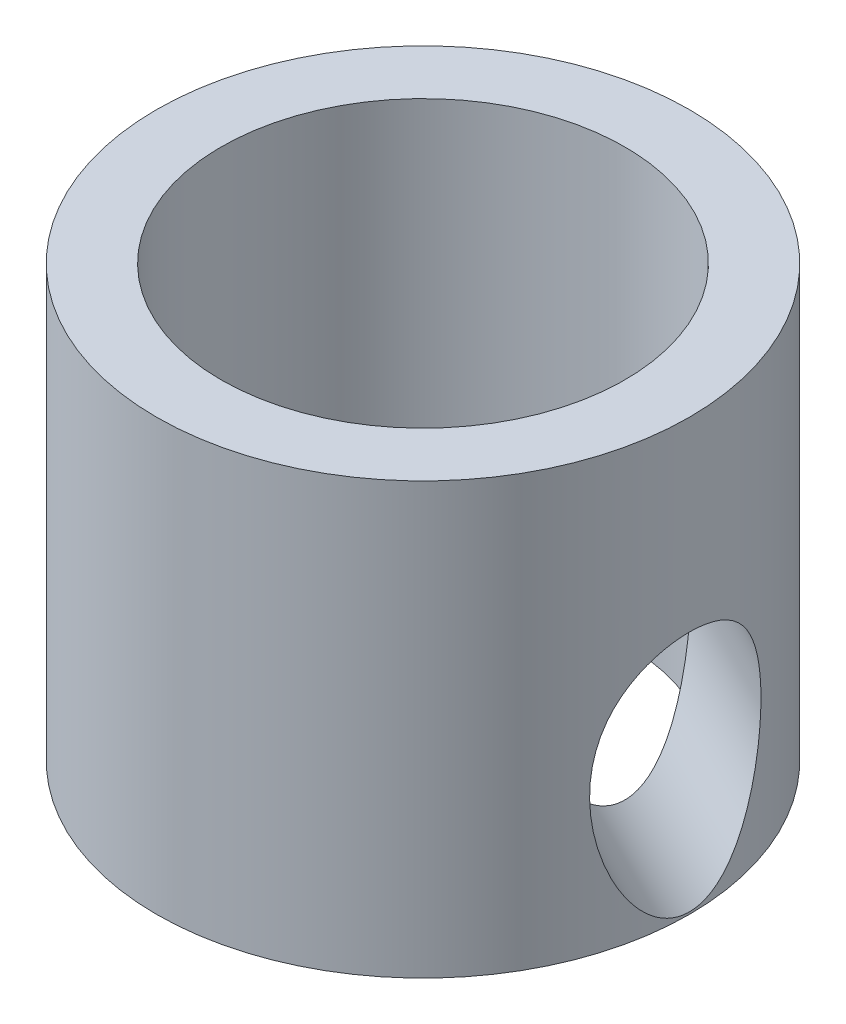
SolidWorks part; units mm, degrees
ref_plane "Front Plane" through (0, 0, 0) normal (0, 0, 1) x (1, 0, 0)
ref_plane "Top Plane" through (0, 0, 0) normal (0, 1, 0) x (1, 0, 0)
ref_plane "Right Plane" through (0, 0, 0) normal (1, 0, 0) x (0, 0, -1)
sketch "Sketch1" plane through (0, 0, 0) normal (0, 1, 0) x (1, 0, 0)
  circle A0 centre (0, 0) radius 62.865
  circle A1 centre (0, 0) radius 47.625
  dimension "D1" = 95.25
  dimension "D2" = 125.73
extrude "Boss-Extrude1" add sketch "Sketch1" along normal blind 101.6
ref_plane "Plane1" through (0, 38.1, 0) normal (0, 1, 0) x (-1, 0, 0)
sketch "Sketch2" plane through (0, 38.1, 0) normal (0, 1, 0) x (-1, 0, 0)
  line L0 (0, 62.865) -> (0, -62.865)
  circle A0 centre (0, 0) radius 62.865 construction
ref_plane "Plane2" through (-19.05, 19.05, 0) normal (0.7071, -0.7071, 0) x (0, 0, -1)
sketch "Sketch3" plane through (-19.05, 19.05, 0) normal (0.7071, -0.7071, 0) x (0, 0, -1)
  line L0 (0, 55) -> (0, -55) construction
  line L1 (-62.865, 26.9408) -> (62.865, 26.9408) construction
  circle A0 centre (0, 65.0408) radius 20.2184
  dimension "D1" = 40.4368
  dimension "D2" = 38.1
extrude "Cut-Extrude1" cut sketch "Sketch3" along normal blind 101.6 and the other way blind 25.4
